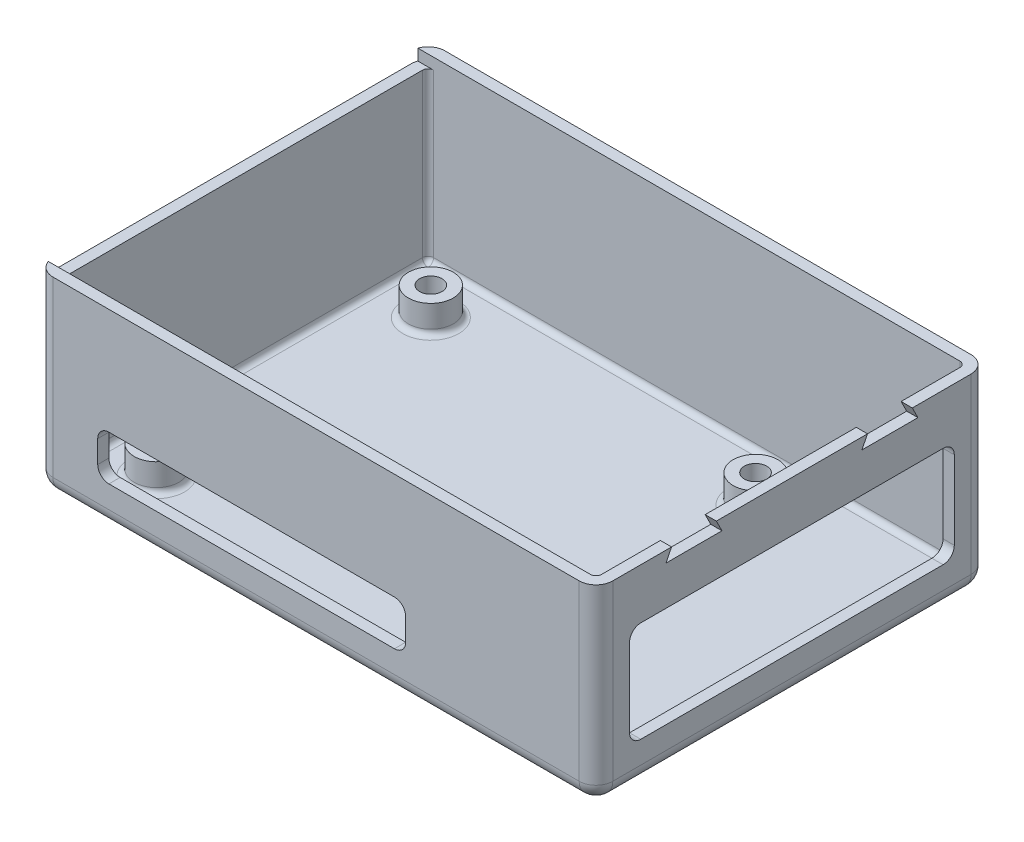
SolidWorks part; units mm, degrees
ref_plane "Front Plane" through (0, 0, 0) normal (0, 0, 1) x (1, 0, 0)
ref_plane "Top Plane" through (0, 0, 0) normal (0, 1, 0) x (1, 0, 0)
ref_plane "Right Plane" through (0, 0, 0) normal (1, 0, 0) x (0, 0, -1)
body saved out of another part "Stock-Enclosure for RaspberryPi-1"
